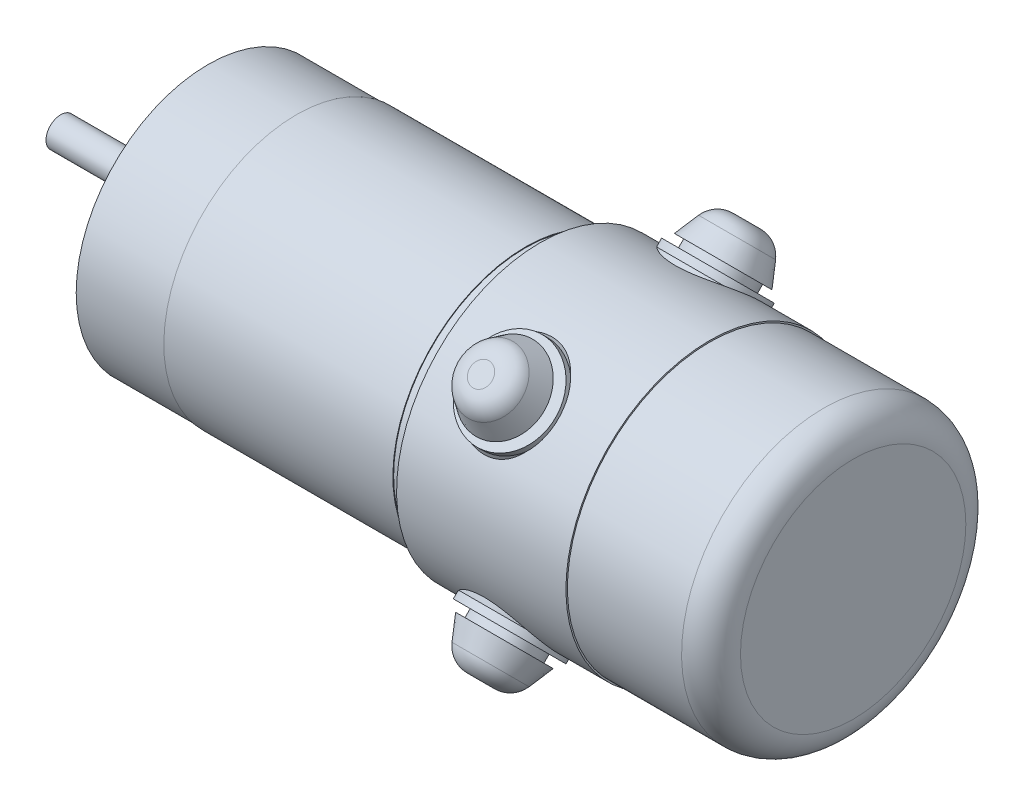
SolidWorks part; units mm, degrees
ref_plane "Plan1" through (0, 0, 0) normal (0, 0, 1) x (1, 0, 0)
ref_plane "Plan2" through (0, 0, 0) normal (0, 1, 0) x (1, 0, 0)
ref_plane "Plan3" through (0, 0, 0) normal (1, 0, 0) x (0, 0, -1)
sketch "Esquisse1" plane through (0, 0, 0) normal (0, 0, 1) x (1, 0, 0)
  line L0 (0, 0) -> (0, 15.3)
  line L1 (-4, 19.3) -> (-19.5, 19.3)
  line L8 (-19.5, 19.3) -> (-19.5, 19.5)
  line L9 (-19.5, 19.5) -> (-42.5, 19.5)
  line L10 (-42.5, 19.5) -> (-42.5, 17.9)
  line L11 (-42.5, 17.9) -> (-44.5, 17.9)
  line L12 (-44.5, 17.9) -> (-44.5, 18)
  line L13 (-44.5, 18) -> (-75.6, 18)
  line L14 (-75.6, 18) -> (-75.6, 17.9)
  line L15 (-75.6, 17.9) -> (-87.6, 17.9)
  line L18 (-87.6, 17.9) -> (-87.6, 9)
  line L19 (0, 0) -> (-126, 0) construction
  line L20 (-87.6, 9) -> (-90.6, 9)
  line L21 (-90.6, 9) -> (-90.6, 1)
  line L22 (-90.6, 1) -> (-83.6, 1)
  line L23 (-83.6, 1) -> (-83.6, 13)
  line L24 (-83.6, 13) -> (-8, 13)
  line L25 (-8, 13) -> (-8, 0)
  line L26 (0, 0) -> (-8, 0)
  arc A0 (0, 15.3) -> (-4, 19.3) centre (-4, 15.3) ccw
  dimension "D19" = 4
  dimension "D1" = 19.3
  dimension "D2" = 19.5
  dimension "D3" = 12
  dimension "D9" = 23
  dimension "D10" = 2
  dimension "D12" = 68.1
  dimension "D13" = 19.5
  dimension "D14" = 18
  dimension "D15" = 17.9
  dimension "D16" = 4
  dimension "D18" = 17.9
  dimension "D20" = 9
  dimension "D21" = 3
  dimension "D22" = 8
  dimension "D23" = 5
  dimension "D24" = 8
revolve "Base-Révolution" add sketch "Esquisse1" angle 360 about L19
sketch "Esquisse2" plane through (-90.6, 0, 0) normal (-1, 0, 0) x (0, 0, 1)
  circle A0 centre (0, 0) radius 2
  dimension "D1" = 4
extrude "Boss.-Extru.1" add sketch "Esquisse2" along normal blind 17
ref_plane "Plan4" through (0, 0, 0) normal (0, 0.7071, 0.7071) x (-1, 0, 0)
ref_plane "Plan5" through (0, 18.0312, 18.0312) normal (0, 0.7071, 0.7071) x (-1, 0, 0)
sketch "Esquisse3" plane through (0, 18.0312, 18.0312) normal (0, 0.7071, 0.7071) x (-1, 0, 0)
  line L0 (0, 0) -> (126, 0) construction
  line L1 (42.5, -19.5) -> (42.5, 19.5) construction
  circle A0 centre (32.5, 0) radius 3.5
  dimension "D1" = 7
  dimension "D2" = 10
extrude "Boss.-Extru.2" add sketch "Esquisse3" against normal up to next draft 23
fillet "Congé1" radius 3 1 edges at (-32.5, 15.5563, 20.5061)
ref_plane "Plan6" through (0, 14.1421, 14.1421) normal (0, 0.7071, 0.7071) x (-1, 0, 0)
sketch "Esquisse4" plane through (0, 14.1421, 14.1421) normal (0, 0.7071, 0.7071) x (-1, 0, 0)
  circle A0 centre (32.5, 0) radius 6.25
  circle A1 centre (32.5, 0) radius 4.2759 construction
  dimension "D1" = 12.5
extrude "Boss.-Extru.3" add sketch "Esquisse4" against normal up to next
sketch "Esquisse5" plane through (0, 14.1421, 14.1421) normal (0, 0.7071, 0.7071) x (-1, 0, 0)
  circle A0 centre (32.5, 0) radius 5.8346
  circle A1 centre (32.5, 0) radius 5.8346 construction
  circle A2 centre (32.5, 0) radius 4.38
  dimension "D1" = 8.76
extrude "Enlèv. mat.-Extru.1" cut sketch "Esquisse5" along normal blind 1
pattern_circular "Répétition circulaire1" count 4 every 90 about axis through (0, 0, 0) along (1, 0, 0) of "Enlèv. mat.-Extru.1", "Boss.-Extru.3", "Congé1", "Boss.-Extru.2"
hole_wizard "Trou taraudé M4x0.71" positions "Esquisse7" profile "Esquisse6" tap size "M4x0.7" standard "ISO"
sketch "Esquisse7" plane through (-87.6, 0, 0) normal (-1, 0, 0) x (0, 0, 1)
  line L0 (12.994, 12.994) -> (13.4502, 13.4502) construction
  circle A0 centre (0, 0) radius 14 construction
  point P0 (9.8995, 9.8995)
  dimension "D1" = 28
sketch "Esquisse6" plane through (-87.6, 9.8995, 9.8995) normal (0, 1, 0) x (0, 0, 1)
  line L0 (0, 0) -> (0, 9.4914)
  line L1 (0, 9.4914) -> (1.65, 8.5)
  line L2 (1.65, 8.5) -> (1.65, 0)
  line L5 (1.65, 0) -> (0, 0)
  line L10 (0, 9.4914) -> (-1.65, 8.5) construction
  line L11 (0, -6.35) -> (0, 107.95) construction
  dimension "Diamètre du trou pour taraudage" = 3.3
  dimension "Profondeur du trou pour taraudage" = 8.5
  dimension "Angle de pointe" = 118
pattern_circular "Répétition circulaire2" count 4 over 360 about axis through (0, 0, 0) along (1, 0, 0) of "Trou taraudé M4x0.71"
